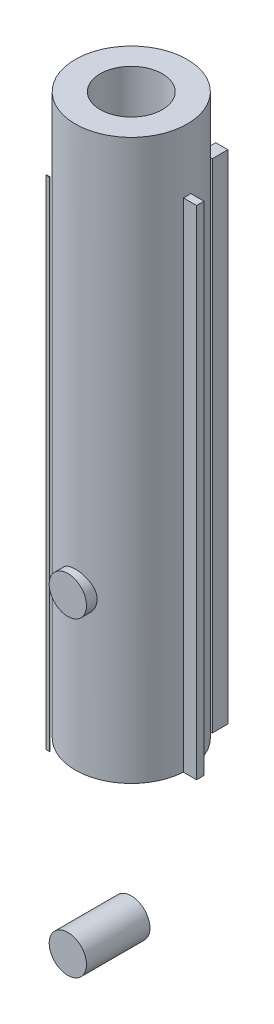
SolidWorks part; units mm, degrees
ref_plane "Front Plane" through (0, 0, 0) normal (0, 0, 1) x (1, 0, 0)
ref_plane "Top Plane" through (0, 0, 0) normal (0, 1, 0) x (1, 0, 0)
ref_plane "Right Plane" through (0, 0, 0) normal (1, 0, 0) x (0, 0, -1)
sketch "Sketch1" plane through (0, 0, 0) normal (0, 1, 0) x (1, 0, 0)
  circle A0 centre (0, 0) radius 9000
  circle A1 centre (0, 0) radius 5000
extrude "Boss-Extrude1" add sketch "Sketch1" along normal blind 90000
sketch "Sketch2" plane through (0, 0, 0) normal (0, 1, 0) x (1, 0, 0)
  line L1 (8400, -600) -> (11100, -600)
  line L2 (8400, -600) -> (8400, 600)
  line L3 (8400, 600) -> (11100, 600)
  line L4 (11100, -600) -> (11100, 600)
  line L5 (3900, 7194.2286) -> (5850, 7194.2286)
  line L6 (3900, 7194.2286) -> (3900, 9693.2667)
  line L7 (3900, 9693.2667) -> (5850, 9693.2667)
  line L8 (5850, 7194.2286) -> (5850, 9693.2667)
  line L9 (-5204.9339, 7342.2519) -> (-4650, 7342.2519)
  line L10 (-5204.9339, 7342.2519) -> (-5204.9339, 9693.2667)
  line L11 (-5204.9339, 9693.2667) -> (-4650, 9693.2667)
  line L12 (-4650, 7342.2519) -> (-4650, 9693.2667)
  line L13 (-9600, -600) -> (-9900, -600)
  line L14 (-9600, -600) -> (-9600, 600)
  line L15 (-9600, 600) -> (-9900, 600)
  line L16 (-9900, -600) -> (-9900, 600)
  line L17 (-5204.9339, -8394.2286) -> (-4650, -8394.2286)
  line L18 (-5204.9339, -8394.2286) -> (-5204.9339, -8493.2667)
  line L19 (-5204.9339, -8493.2667) -> (-4650, -8493.2667)
  line L20 (-4650, -8394.2286) -> (-4650, -8493.2667)
  circle A0 centre (0, 0) radius 9000 construction
extrude "Boss-Extrude2" add sketch "Sketch2" along normal blind 80000
sketch "Sketch3" plane through (0, 0, 0) normal (0, 0, 1) x (1, 0, 0)
  circle A0 centre (0, 25000) radius 3000
  circle A1 centre (0, -25000) radius 3000
extrude "Boss-Extrude3" add sketch "Sketch3" along normal blind 10200
